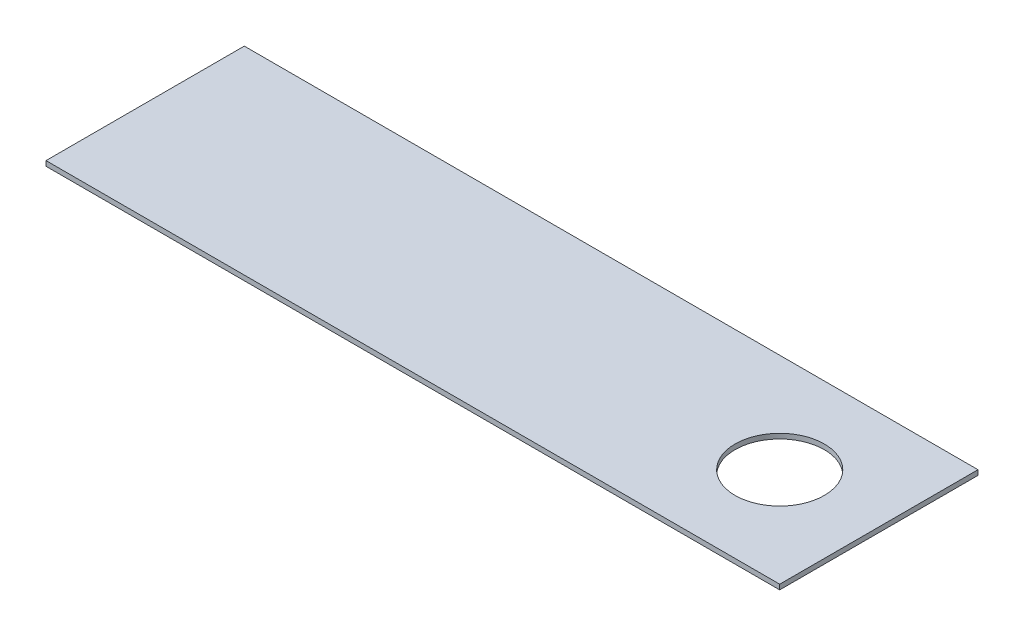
SolidWorks part; units mm, degrees
ref_plane "Front" through (0, 0, 0) normal (0, 0, 1) x (1, 0, 0)
ref_plane "Top" through (0, 0, 0) normal (0, 1, 0) x (1, 0, 0)
ref_plane "Right" through (0, 0, 0) normal (1, 0, 0) x (0, 0, -1)
sketch "Sketch1" plane through (0, 0, 0) normal (0, 1, 0) x (1, 0, 0)
  line L1 (0, 0) -> (37, 0)
  line L2 (0, 0) -> (0, 10)
  line L3 (0, 10) -> (37, 10)
  line L4 (37, 0) -> (37, 10)
  circle A0 centre (32, 5) radius 2.25
extrude "Extrude1" add sketch "Sketch1" along normal blind 0.25
